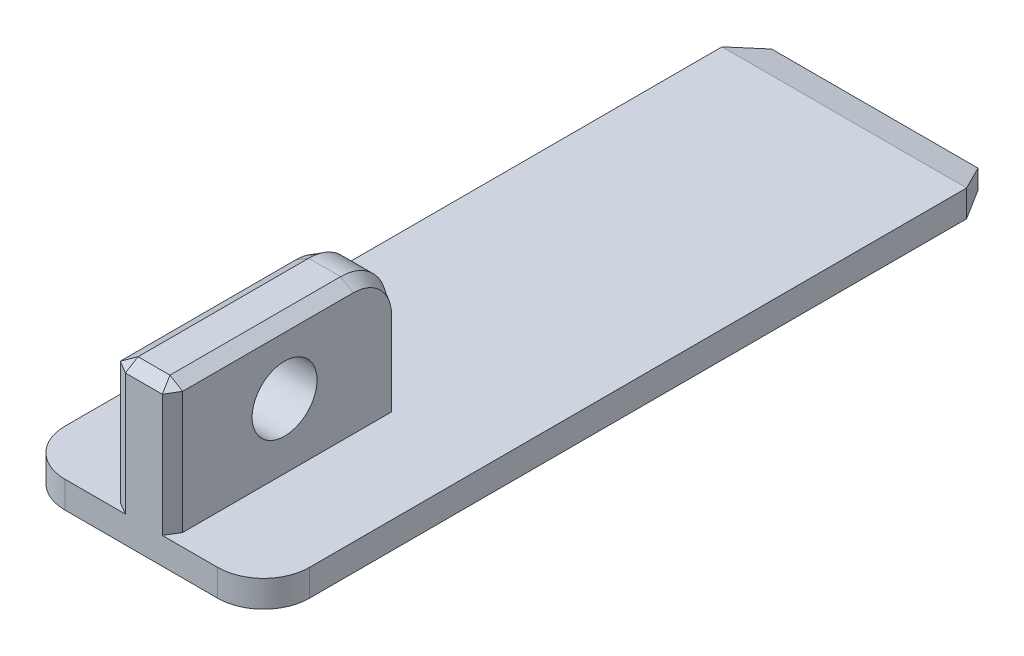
SolidWorks part; units mm, degrees
ref_plane "Ebene vorne" through (0, 0, 0) normal (0, 0, 1) x (1, 0, 0)
ref_plane "Ebene oben" through (0, 0, 0) normal (0, 1, 0) x (1, 0, 0)
ref_plane "Ebene rechts" through (0, 0, 0) normal (1, 0, 0) x (0, 0, -1)
sketch "Skizze1" plane through (0, 0, 0) normal (0, 0, 1) x (1, 0, 0)
  line L1 (-16, 1.75) -> (16, 1.75)
  line L2 (-16, 1.75) -> (-16, -1.75)
  line L3 (-16, -1.75) -> (16, -1.75)
  line L4 (16, 1.75) -> (16, -1.75)
  line L5 (-16, 1.75) -> (16, -1.75) construction
  line L6 (-16, -1.75) -> (16, 1.75) construction
  point P0 (0, 0)
  dimension "D1" = 32
  dimension "D2" = 3.5
extrude "Aufsatz-Linear austragen1" add sketch "Skizze1" along normal blind 96
chamfer "Fase1" distance 2.5 distance2 4 2 edges at (-16, 0, 0) (16, 0, 0)
chamfer "Fase2" distance 1 distance2 4 1 edges at (0, 1.75, 0)
sketch "Skizze2" plane through (0, 1.75, 0) normal (0, 1, 0) x (1, 0, 0)
  line L0 (0, -96) -> (0, -85.1947) construction
  line L1 (16, -96) -> (-16, -96) construction
  line L2 (-3.75, -96) -> (-3.75, -66)
  line L3 (-3.75, -66) -> (3.75, -66)
  line L4 (3.75, -96) -> (3.75, -66)
  line L5 (3.75, -96) -> (-3.75, -96)
  point P9 (0, -66)
  dimension "D1" = 7.5
  dimension "D2" = 30
extrude "Aufsatz-Linear austragen2" add sketch "Skizze2" along normal blind 17
sketch "Skizze3" plane through (3.75, 0, 0) normal (1, 0, 0) x (0, 0, -1)
  line L0 (-96, 10.25) -> (-66, 10.25) construction
  line L1 (-96, 18.75) -> (-96, 1.75) construction
  line L2 (-66, 18.75) -> (-66, 1.75) construction
  circle A0 centre (-81, 10.25) radius 4.25
  dimension "D1" = 8.5
  dimension "D2" = 15
extrude "Schnitt-Linear austragen1" cut sketch "Skizze3" against normal through all
fillet "Verrundung1" radius 6 1 edges at (0, 18.75, 66)
fillet "Verrundung2" radius 6 2 edges at (-16, 0, 96) (16, 0, 96)
chamfer "Fase3" distance 1 angle 59 9 edges at (3.75, 7.25, 66) (3.75, 16.9926, 67.7574) (3.75, 18.75, 84) (-3.75, 7.25, 66) (-3.75, 16.9926, 67.7574) (-3.75, 18.75, 84) (0, 18.75, 96) (3.75, 10.25, 96) (-3.75, 10.25, 96)
